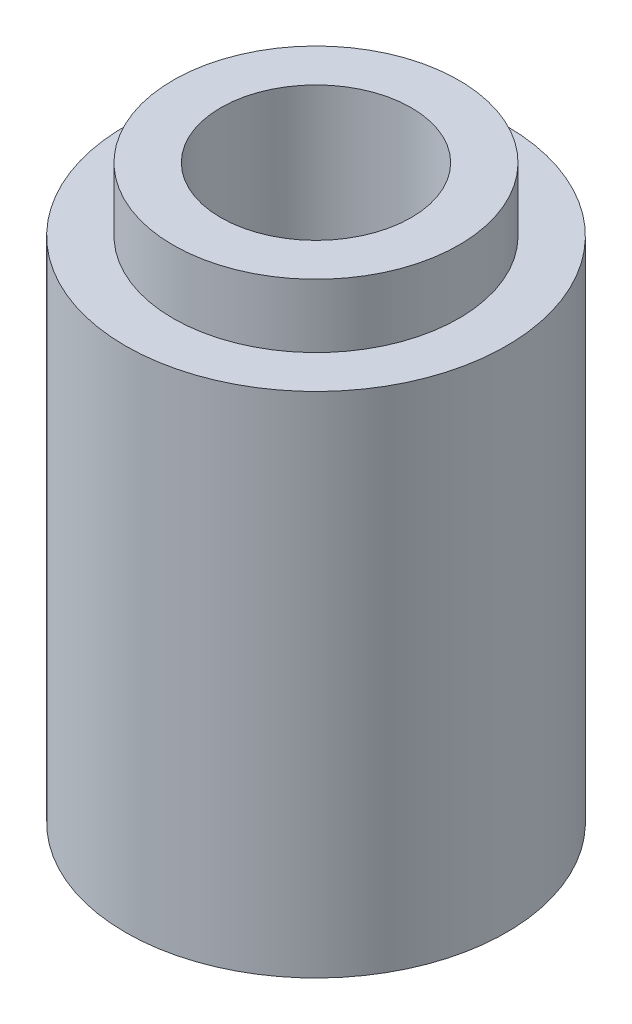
SolidWorks part; units mm, degrees
ref_plane "Спереди" through (0, 0, 0) normal (0, 0, 1) x (1, 0, 0)
ref_plane "Сверху" through (0, 0, 0) normal (0, 1, 0) x (1, 0, 0)
ref_plane "Справа" through (0, 0, 0) normal (1, 0, 0) x (0, 0, -1)
sketch "Эскиз1" plane through (0, 0, 0) normal (0, 1, 0) x (1, 0, 0)
  circle A0 centre (0, 0) radius 3
extrude "Бобышка-Вытянуть1" add sketch "Эскиз1" along normal blind 8
sketch "Эскиз2" plane through (0, 8, 0) normal (0, 1, 0) x (1, 0, 0)
  circle A0 centre (0, 0) radius 2.25
extrude "Бобышка-Вытянуть2" add sketch "Эскиз2" along normal blind 1
sketch "Эскиз3" plane through (0, 0, 0) normal (0, -1, 0) x (1, 0, 0)
  circle A0 centre (0, 0) radius 1.5
extrude "Вырез-Вытянуть1" cut sketch "Эскиз3" against normal up to surface (9 mm away)
